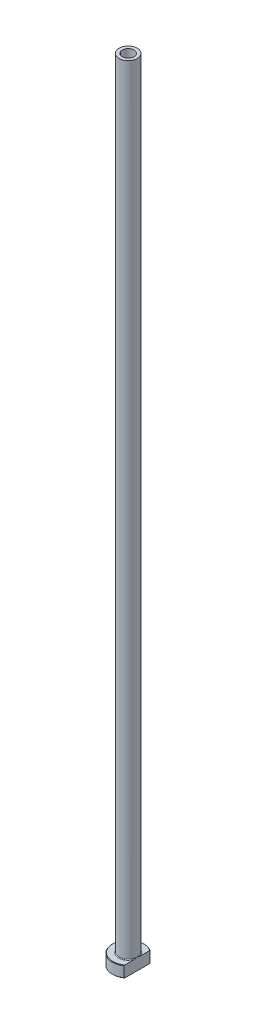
SolidWorks part; units mm, degrees
ref_plane "Front Plane" through (0, 0, 0) normal (0, 0, 1) x (1, 0, 0)
ref_plane "Top Plane" through (0, 0, 0) normal (0, 1, 0) x (1, 0, 0)
ref_plane "Right Plane" through (0, 0, 0) normal (1, 0, 0) x (0, 0, -1)
sketch "Sketch1" plane through (0, 0, 0) normal (0, 0, 1) x (1, 0, 0)
  line L0 (-2.6, 350) -> (-4, 350)
  line L1 (-4, 350) -> (-4, 5)
  line L2 (-4, 5) -> (-7, 5)
  line L3 (-7, 5) -> (-7, 0)
  line L4 (6.05, 0) -> (-6.05, 0) construction
  line L5 (-7, 0) -> (-2.85, 0)
  line L6 (-2.6, 305) -> (-2.6, 350)
  line L7 (0, 92.1877) -> (0, -15.5353) construction
  line L8 (0, -7.7) -> (0, 7.7) construction
  line L9 (-2.6, 305) -> (-2.85, 293)
  line L10 (-2.85, 293) -> (-2.85, 0)
  dimension "D1" = 0.25
  dimension "ID" = 5.2
  dimension "OD" = 8
  dimension "L" = 350
  dimension "H" = 14
  dimension "T" = 5
  dimension "N" = 45
  dimension "D2" = 12
  dimension "L-N" = 305
revolve "Revolve1" add sketch "Sketch1" angle 360 about L7
fillet "Fillet1" radius 0.3 1 edges at (0, 5, 4)
chamfer "Chamfer1" distance 0.2 angle 45 2 edges at (0, 5, 7) (0, 0, 7)
sketch "Sketch2" plane through (0, 0, 0) normal (0, -1, 0) x (1, 0, 0)
  line L0 (4, 5.7446) -> (4, -5.7446)
  circle A0 centre (0, 0) radius 7 construction
  arc A1 (4, 5.7446) -> (4, -5.7446) centre (0, 0) cw
  circle A2 centre (0, 0) radius 4 construction
extrude "Cut-Extrude1" cut sketch "Sketch2" against normal through all
chamfer "Chamfer2" distance 0.5 angle 45 1 edges at (0, 0, 2.85)
